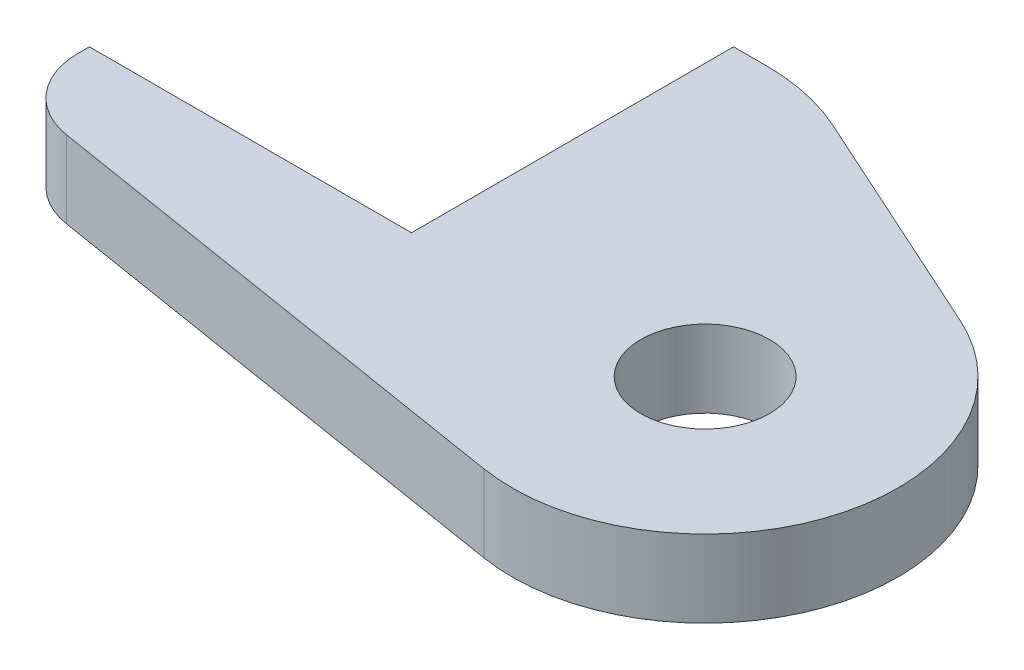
SolidWorks part; units mm, degrees
ref_plane "Front Plane" through (0, 0, 0) normal (0, 0, 1) x (1, 0, 0)
ref_plane "Top Plane" through (0, 0, 0) normal (0, 1, 0) x (1, 0, 0)
ref_plane "Right Plane" through (0, 0, 0) normal (1, 0, 0) x (0, 0, -1)
sketch "w665" plane through (0, 0, 0) normal (0, 1, 0) x (1, 0, 0)
  point P1 (35.941, 0)
  line B0 (-224.155, -274.828) -> (-224.155, -160.02)
  line B1 (-224.155, -160.02) -> (-51.181, -160.02)
  line B2 (-35.941, -144.78) -> (-35.941, 144.78)
  line B3 (-51.181, 160.02) -> (-224.155, 160.02)
  line B4 (-224.155, 160.02) -> (-224.155, 274.828)
  line B5 (-224.155, 274.828) -> (224.155, 274.828)
  line B6 (224.155, 274.828) -> (224.155, 160.02)
  line B7 (224.155, 160.02) -> (51.181, 160.02)
  line B8 (35.941, 144.78) -> (35.941, -144.78)
  line B9 (51.181, -160.02) -> (224.155, -160.02)
  line B10 (224.155, -160.02) -> (224.155, -274.828)
  line B11 (224.155, -274.828) -> (-224.155, -274.828)
  line B12 (0, -346.9641) -> (0, 274.828) construction
  arc B13 (-51.181, -160.02) -> (-35.941, -144.78) centre (-51.181, -144.78) ccw
  arc B14 (-35.941, 144.78) -> (-51.181, 160.02) centre (-51.181, 144.78) ccw
  arc B15 (51.181, 160.02) -> (35.941, 144.78) centre (51.181, 144.78) ccw
  arc B16 (35.941, -144.78) -> (51.181, -160.02) centre (51.181, -144.78) ccw
sketch_block_instance "W14x665-1"
sketch_block "W14x665" parameters "D6"=15.24, "D1"=71.882, "D2"=448.31, "D3"=549.656, "D4"=114.808, "D5"=114.808, "D7"=35.941
sketch "w193" plane through (0, 0, 0) normal (0, 1, 0) x (1, 0, 0)
  point P0 (11.303, 0)
  line B0 (-199.517, -196.596) -> (-199.517, -160.02)
  line B1 (-199.517, -160.02) -> (-26.543, -160.02)
  line B2 (-11.303, -144.78) -> (-11.303, 144.78)
  line B3 (-26.543, 160.02) -> (-199.517, 160.02)
  line B4 (-199.517, 160.02) -> (-199.517, 196.596)
  line B5 (-199.517, 196.596) -> (199.517, 196.596)
  line B6 (199.517, 196.596) -> (199.517, 160.02)
  line B7 (199.517, 160.02) -> (26.543, 160.02)
  line B8 (11.303, 144.78) -> (11.303, -144.78)
  line B9 (26.543, -160.02) -> (199.517, -160.02)
  line B10 (199.517, -160.02) -> (199.517, -196.596)
  line B11 (199.517, -196.596) -> (-199.517, -196.596)
  line B12 (0, -196.596) -> (0, 196.596) construction
  arc B13 (-26.543, -160.02) -> (-11.303, -144.78) centre (-26.543, -144.78) ccw
  arc B14 (-11.303, 144.78) -> (-26.543, 160.02) centre (-26.543, 144.78) ccw
  arc B15 (26.543, 160.02) -> (11.303, 144.78) centre (26.543, 144.78) ccw
  arc B16 (11.303, -144.78) -> (26.543, -160.02) centre (26.543, -144.78) ccw
sketch_block_instance "W14x193-1-1"
sketch_block "W14x193-1" parameters "D6"=15.24, "D1"=22.606, "D2"=399.034, "D3"=393.192, "D4"=36.576, "D5"=36.576, "D7"=11.303
sketch "C6" plane through (0, 0, 0) normal (0, 1, 0) x (1, 0, 0)
  line L3 (224.155, 274.828) -> (224.155, 160.02) construction
  line L9 (224.155, 414.1441) -> (226.8118, 414.1441)
  line L10 (224.155, 414.1441) -> (224.155, 261.7441)
  line L11 (224.155, 261.7441) -> (226.8118, 261.7441)
  line L12 (226.8118, 414.1441) -> (226.8118, 261.7441)
  line L13 (224.155, 160.02) -> (51.181, 160.02) construction
  circle A0 centre (260.8161, 159.5967) radius 6.7469
  point P4 (254.0692, 159.5967)
  point P5 (270.4998, 337.9441)
  point P10 (267.563, 159.5967)
  line B0 (278.4754, 414.1441) -> (278.4754, 261.7441)
  line B1 (278.4754, 261.7441) -> (226.8118, 261.7441)
  line B2 (278.4754, 414.1441) -> (226.8118, 414.1441)
  line B3 (254.104, 405.4319) -> (279.504, 405.4319) construction
  line B4 (270.4998, 280.5522) -> (270.4998, 395.3359)
  line B5 (226.8118, 261.7441) -> (226.8118, 264.2333)
  line B6 (226.8118, 414.1441) -> (226.8118, 411.6548)
  line B7 (264.1326, 273.0359) -> (229.3587, 267.2399)
  line B8 (264.1326, 402.8522) -> (229.3587, 408.6483)
  arc B9 (270.4998, 395.3359) -> (264.1326, 402.8522) centre (262.8798, 395.3359) ccw
  arc B10 (270.4998, 280.5522) -> (264.1326, 273.0359) centre (262.8798, 280.5522) cw
  arc B11 (226.8118, 264.2333) -> (229.3587, 267.2399) centre (229.8598, 264.2333) cw
  arc B12 (226.8118, 411.6548) -> (229.3587, 408.6483) centre (229.8598, 411.6548) ccw
  dimension "D4" = 0.4233
  dimension "D2" = 13.4937
  dimension "D1" = 17.6593
  dimension "D3" = 2.6568
sketch_block_instance "C6x10.5-1"
sketch_block "C6x10.5" parameters "D3"=7.62, "D6"=3.048, "D1"=152.4, "D2"=51.6636, "D4"=7.9756, "D5"=9.463, "D7"=2.4893, "D8"=8.7122, "D9"=12.6836
sketch "Sketch1" plane through (0, 0, 0) normal (0, 1, 0) x (1, 0, 0)
  line L14 (224.155, 160.02) -> (224.155, 196.596)
  line L17 (224.155, 274.828) -> (224.155, 160.02) construction
  line L18 (224.155, 196.596) -> (231.3691, 196.596)
  line L19 (224.155, 160.02) -> (187.579, 160.02)
  line L20 (224.155, 160.02) -> (51.181, 160.02) construction
  line L21 (187.579, 160.02) -> (187.579, 155.4282)
  line L22 (195.5832, 146.0254) -> (257.0141, 136.0896)
  line L23 (241.8519, 194.332) -> (270.6436, 181.2866)
  circle A17 centre (260.8161, 159.5967) radius 7.9375
  circle A19 centre (260.8161, 159.5967) radius 13.4874 construction
  arc A20 (257.0141, 136.0896) -> (270.6436, 181.2866) centre (260.8161, 159.5967) ccw
  circle A21 centre (260.8161, 159.5967) radius 6.7469 construction
  circle A22 centre (260.8161, 159.5967) radius 23.8125 construction
  arc A23 (187.579, 155.4282) -> (195.5832, 146.0254) centre (197.104, 155.4282) ccw
  arc A24 (231.3691, 196.596) -> (241.8519, 194.332) centre (231.3691, 171.196) cw
  point P27 (187.579, 147.32)
  point P32 (236.855, 196.596)
  dimension "D6" = 15.875
  dimension "D7" = 12.7
  dimension "D8" = 12.7
  dimension "D5" = 36.576
  dimension "D10" = 15.875
  dimension "D12" = 25.4
  dimension "D9" = 26.9748
  dimension "D11" = 9.525
  dimension "D3" = 36.576
extrude "Boss-Extrude1" add sketch "Sketch1" along normal mid plane 9.525
chamfer "Chamfer1" distance 3.175 angle 45 4 edges at (205.867, 4.7625, -160.02) (224.155, 4.7625, -178.308) (205.867, -4.7625, -160.02) (224.155, -4.7625, -178.308)
ref_plane "hole cntr a" through (260.8161, 0, 0) normal (1, 0, 0) x (0, 0, -1)
ref_plane "hole cntr b" through (0, 0, -159.5967) normal (0, 0, 1) x (1, 0, 0)
